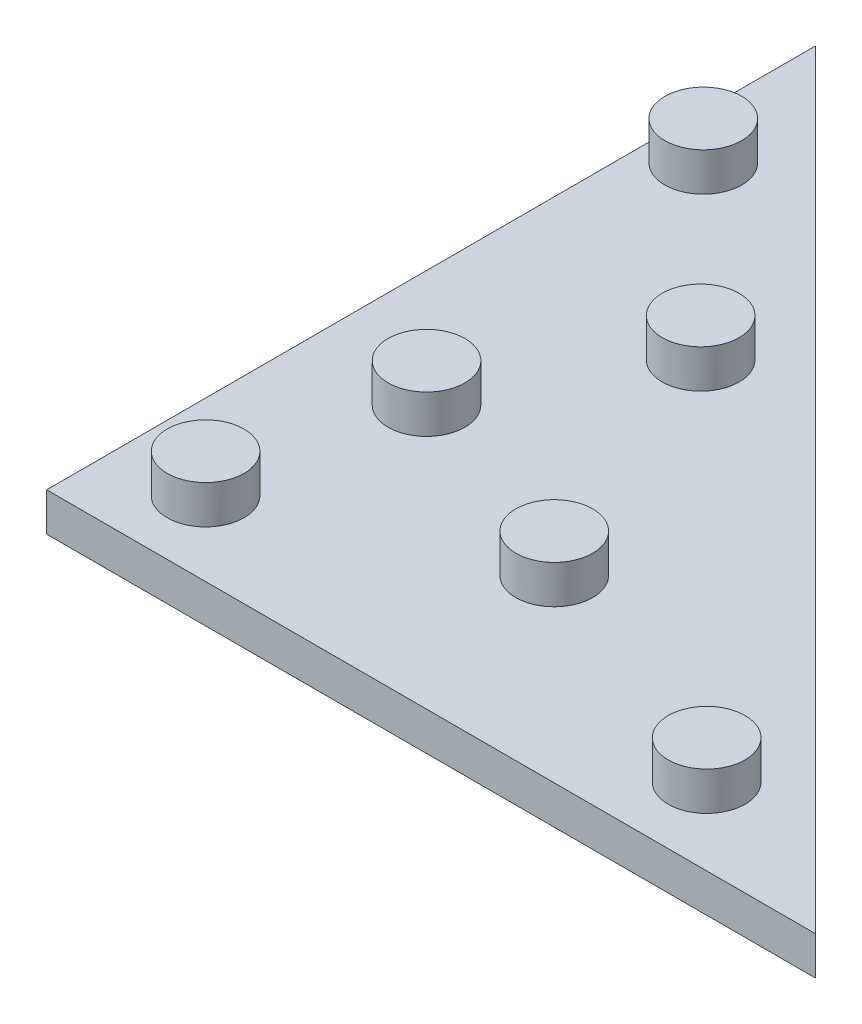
SolidWorks part; units mm, degrees
ref_plane "Front Plane" through (0, 0, 0) normal (0, 0, 1) x (1, 0, 0)
ref_plane "Top Plane" through (0, 0, 0) normal (0, 1, 0) x (1, 0, 0)
ref_plane "Right Plane" through (0, 0, 0) normal (1, 0, 0) x (0, 0, -1)
sketch "Sketch1" plane through (0, 0, 0) normal (0, 1, 0) x (1, 0, 0)
  line L0 (0, 0) -> (0, 100)
  line L1 (0, 100) -> (100, 0)
  line L2 (100, 0) -> (0, 0)
  dimension "D1" = 45
  dimension "D2" = 100
extrude "Extrude1" add sketch "Sketch1" along normal blind 5
sketch "Sketch2" plane through (0, 5, 0) normal (0, 1, 0) x (-1, 0, 0)
  point P0 (-10.9891, -9.6887)
  point P1 (-15.1621, -34.2544)
  point P2 (-42.6652, -23.3712)
  point P3 (-27.8957, -57.1843)
  point P4 (-5.8768, -79.5495)
  dimension "D1" = 5.8768
  dimension "D2" = 10.9891
  dimension "D3" = 15.1621
  dimension "D4" = 27.8957
  dimension "D5" = 42.6652
  dimension "D6" = 9.6887
  dimension "D7" = 23.3712
  dimension "D8" = 34.2544
  dimension "D9" = 57.1843
  dimension "D10" = 79.5495
sketch "Sketch5" plane through (0, 5, 0) normal (0, 1, 0) x (-1, 0, 0)
  line L0 (0, 0) -> (-100, 0) construction
  line L1 (-100, 0) -> (0, -100) construction
  circle A0 centre (-75.8579, -10) radius 5
  dimension "D3" = 10
  dimension "D1" = 10
  dimension "D2" = 10
extrude "Extrude2" add sketch "Sketch5" along normal blind 5
pattern_sketch "Sketch-Pattern1" of "Extrude2"
